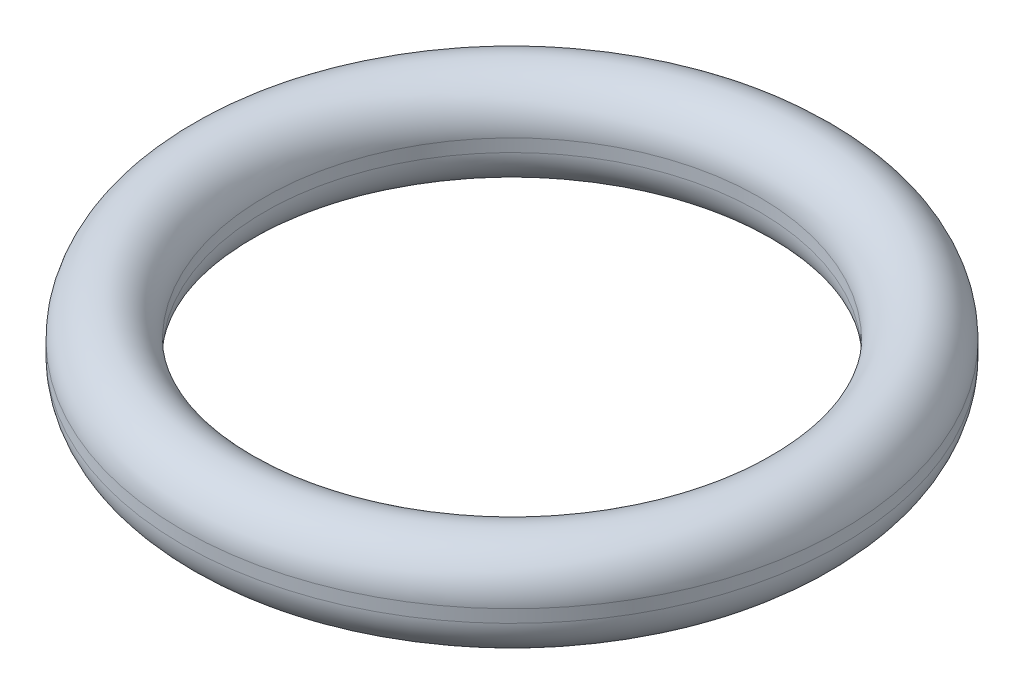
SolidWorks part; units mm, degrees
ref_plane "Front Plane" through (0, 0, 0) normal (0, 0, 1) x (1, 0, 0)
ref_plane "Top Plane" through (0, 0, 0) normal (0, 1, 0) x (1, 0, 0)
ref_plane "Right Plane" through (0, 0, 0) normal (1, 0, 0) x (0, 0, -1)
sketch "Sketch1" plane through (0, 0, 0) normal (0, 0, 1) x (1, 0, 0)
  line L0 (0, 0) -> (0, 44.1863) construction
  line L1 (2.4765, 0) -> (2.4765, 0.127)
  line L2 (3.302, 0.127) -> (3.302, 0)
  arc A0 (2.4765, 0.127) -> (3.302, 0.127) centre (2.8893, 0.127) cw
  arc A1 (3.302, 0) -> (2.4765, 0) centre (2.8893, 0) cw
  dimension "D1" = 4.953
  dimension "D2" = 6.604
  dimension "D3" = 0.127
revolve "Revolve1" add sketch "Sketch1" angle 360 about L0
